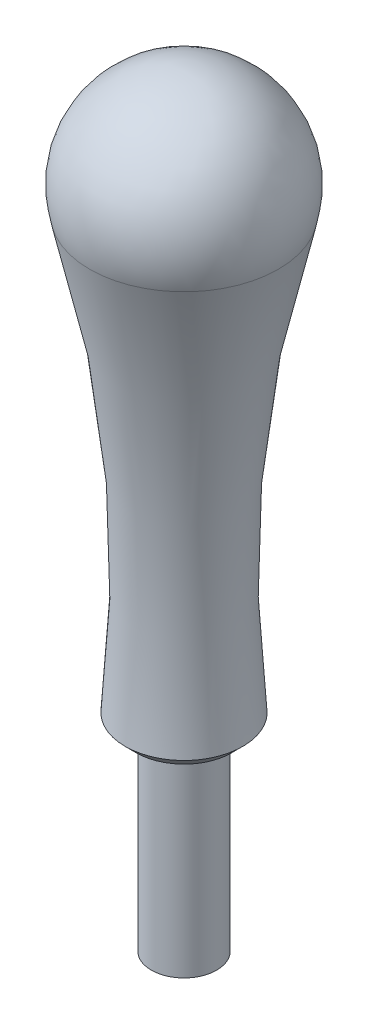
SolidWorks part; units mm, degrees
ref_plane "Front" through (0, 0, 0) normal (0, 0, 1) x (1, 0, 0)
ref_plane "Top" through (0, 0, 0) normal (0, 1, 0) x (1, 0, 0)
ref_plane "Right" through (0, 0, 0) normal (1, 0, 0) x (0, 0, -1)
sketch "Sketch1" plane through (0, 0, 0) normal (0, 0, 1) x (1, 0, 0)
  line L1 (0, 0) -> (0, 116.6569)
  line L2 (0, 0) -> (-5, 0)
  line L3 (-5, 0) -> (-5, 30)
  line L4 (-9, 31.6569) -> (-7.3431, 30)
  line L5 (0, 0) -> (0, -19.3749) construction
  line L6 (-7.3431, 30) -> (-5, 30)
  arc A0 (0, 116.6569) -> (-14.4507, 97.6348) centre (0, 101.6569) ccw
  arc A1 (-14.4507, 97.6348) -> (-9, 31.6569) centre (-184.1593, 50.4003) cw
  dimension "D2" = 85
  dimension "D4" = 45
  dimension "D7" = 10
  dimension "D1" = 16
  dimension "D3" = 15
  dimension "D5" = 18
  dimension "D6" = 30
revolve "Revolve1" add sketch "Sketch1" angle 360 about L5
